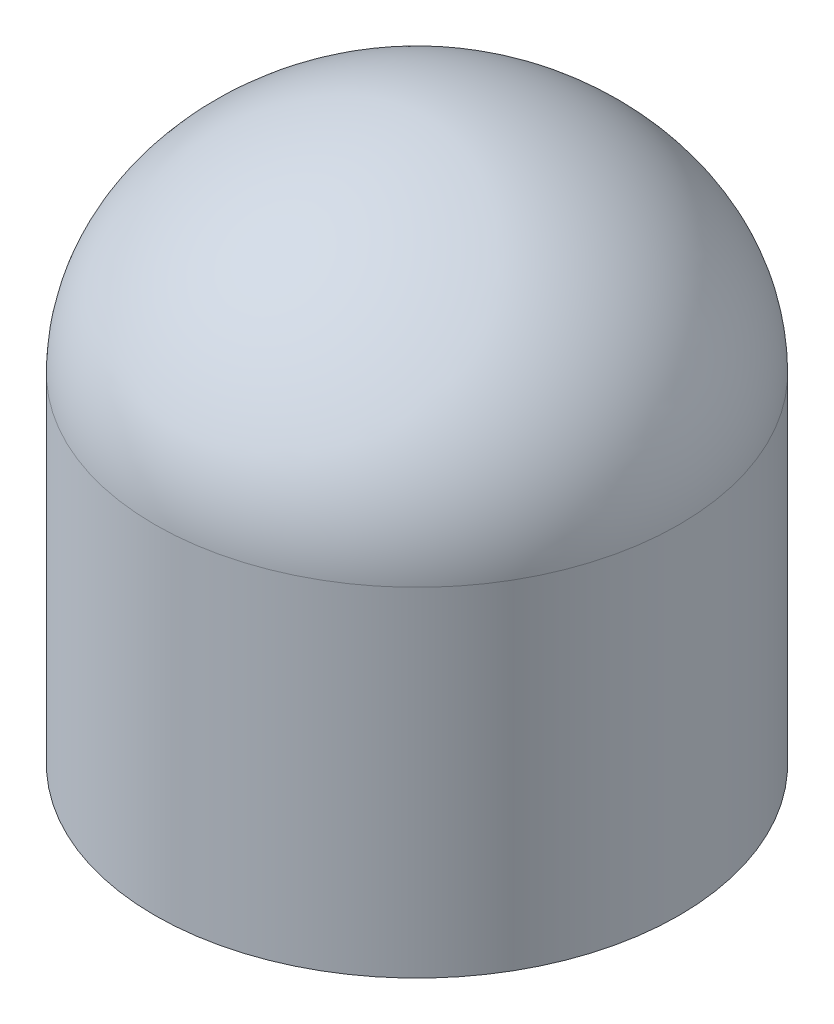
SolidWorks part; units mm, degrees
ref_plane "Plan de face" through (0, 0, 0) normal (0, 0, 1) x (1, 0, 0)
ref_plane "Plan de dessus" through (0, 0, 0) normal (0, 1, 0) x (1, 0, 0)
ref_plane "Plan de droite" through (0, 0, 0) normal (1, 0, 0) x (0, 0, -1)
ref_plane "Plan1" through (0, 0, 334.5) normal (0, 0, 1) x (1, 0, 0)
sketch "Esquisse3" plane through (0, 0, 334.5) normal (0, 0, 1) x (1, 0, 0)
  line L0 (-11.8769, 91.9883) -> (-11.8769, 24.6777) construction
  line L1 (7.6231, -5.5112) -> (7.6231, 66.4888) construction
  line L2 (1.6231, 80.15) -> (7.6231, 83.6141)
  line L3 (7.6231, 61.7126) -> (7.6231, 100.4913) construction
  line L6 (-11.8769, 30.15) -> (0.6231, 30.15)
  line L7 (0.6231, 30.15) -> (0.6231, 80.15)
  line L8 (0.6231, 80.15) -> (1.6231, 80.15)
  line L10 (7.6231, 83.6141) -> (7.6231, 90.15)
  line L13 (-11.8769, 30.15) -> (-11.8769, 73.6317)
  spline S0 degree 3 poles (-11.8769, 73.6317) (-11.8769, 83.2203) (-1.1558, 90.15) (7.6231, 90.15) knots 0 0 0 0 1 1 1 1
  dimension "D1" = 19.5
  dimension "D2" = 7
  dimension "D3" = 60
  dimension "D4" = 6
  dimension "D5" = 50
  dimension "D6" = 60
revolve "Révolution1" add sketch "Esquisse3" angle 360 about L10
sketch "Esquisse4" plane through (0, 0, 0) normal (0, 0, 1) x (1, 0, 0)
  line L0 (-11.8769, 30.15) -> (27.1231, 30.15) construction
  line L1 (-29.9179, 48.45) -> (48.9824, 48.45)
  line L2 (-29.9179, 48.45) -> (-29.9179, 12.5082)
  line L3 (-29.9179, 12.5082) -> (48.9824, 12.5082)
  line L4 (48.9824, 48.45) -> (48.9824, 12.5082)
  dimension "D1" = 18.3
extrude "Enlèv. mat.-Extru.1" cut sketch "Esquisse4" against normal through all and the other way through all
